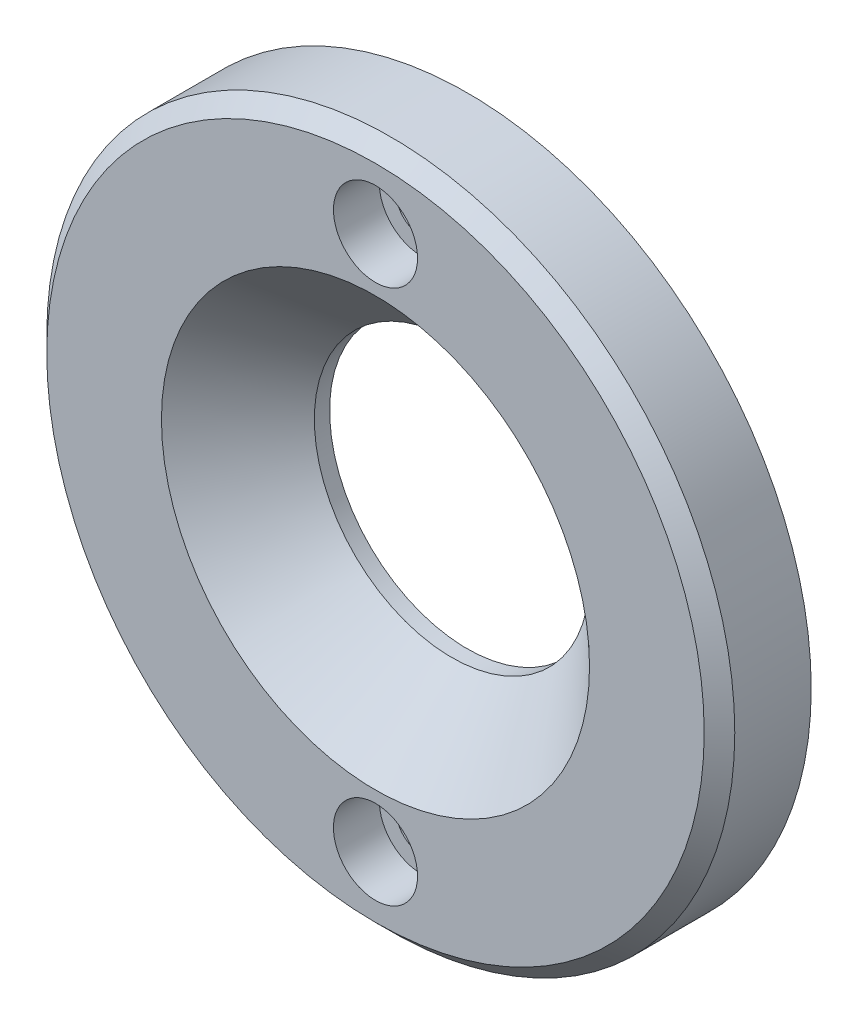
SolidWorks part; units mm, degrees
ref_plane "Face" through (0, 0, 0) normal (0, 0, 1) x (1, 0, 0)
ref_plane "Dessus" through (0, 0, 0) normal (0, 1, 0) x (1, 0, 0)
ref_plane "Droite" through (0, 0, 0) normal (1, 0, 0) x (0, 0, -1)
sketch "Esquisse1" plane through (0, 0, 0) normal (0, 0, 1) x (1, 0, 0)
  circle A0 centre (0, 0) radius 45
  dimension "D1" = 90
extrude "Extrusion1" add sketch "Esquisse1" along normal blind 12
chamfer "Chanfrein1" distance 2 angle 45 1 edges at (45, 0, 12)
sketch "Esquisse2" plane through (0, 0, 12) normal (0, 0, 1) x (1, 0, 0)
  circle A0 centre (0, 0) radius 18
  dimension "D1" = 36
extrude "Enlèv. mat.-Extru.1" cut sketch "Esquisse2" against normal through all
chamfer "Chanfrein2" distance 10 angle 45 1 edges at (18, 0, 12)
hole_wizard "Chambrage pour vis à tête hexagonale M61" positions "Esquisse5" profile "Esquisse4" counterbore size "M6" standard "ISO"
sketch "Esquisse5" plane through (0, 0, 12) normal (0, 0, 1) x (1, 0, 0)
  line L0 (-50.7092, 0) -> (53.3688, 0) construction
  line L1 (0, 48.9362) -> (0, -47.8723) construction
  point P0 (0, 35)
  point P1 (0, -35)
  dimension "D1" = 35
  dimension "D2" = 35
sketch "Esquisse4" plane through (0, 35, 12) normal (1, 0, 0) x (0, -1, 0)
  line L0 (0, 0) -> (0, 12)
  line L1 (0, 12) -> (3.3, 12)
  line L3 (3.3, 12) -> (3.3, 6)
  line L4 (3.3, 6) -> (5.5, 6)
  line L5 (5.5, 6) -> (5.5, 0)
  line L7 (5.5, 0) -> (0, 0)
  line L11 (0, -6.35) -> (0, 107.95) construction
  dimension "Diamètre du perçage jusqu'au prochain" = 6.6
  dimension "Profondeur du perçage jusqu'au prochain" = 12
  dimension "Diamètre du chambrage" = 11
  dimension "Profondeur du chambrage" = 6
